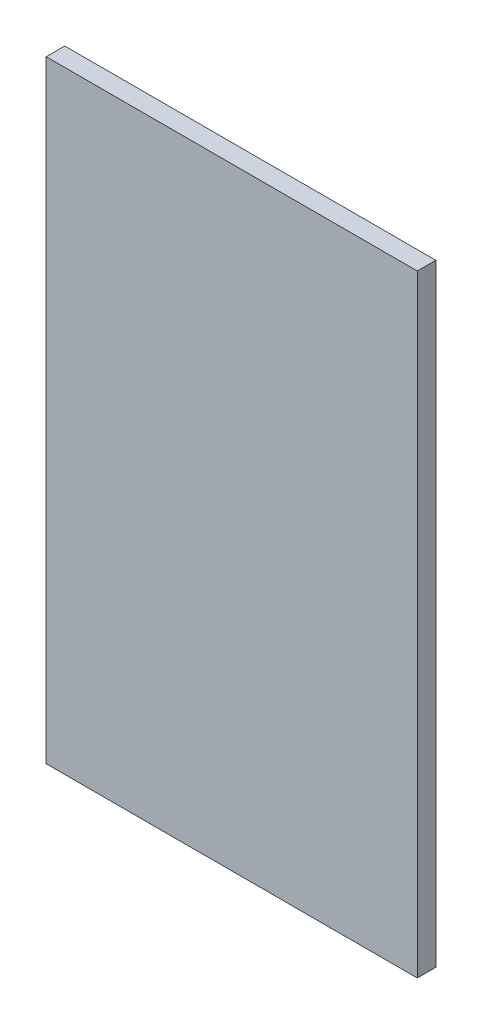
SolidWorks part; units mm, degrees
ref_plane "Front" through (0, 0, 0) normal (0, 0, 1) x (1, 0, 0)
ref_plane "Top" through (0, 0, 0) normal (0, 1, 0) x (1, 0, 0)
ref_plane "Right" through (0, 0, 0) normal (1, 0, 0) x (0, 0, -1)
sketch "草图3" plane through (0, 0, 0) normal (0, 0, 1) x (1, 0, 0)
  line L1 (-19.5514, 19.2123) -> (0.4486, 19.2123)
  line L2 (-19.5514, 19.2123) -> (-19.5514, -13.7877)
  line L3 (-19.5514, -13.7877) -> (0.4486, -13.7877)
  line L4 (0.4486, 19.2123) -> (0.4486, -13.7877)
  dimension "D1" = 33
  dimension "D2" = 20
extrude "凸台-拉伸1" add sketch "草图3" along normal blind 1
